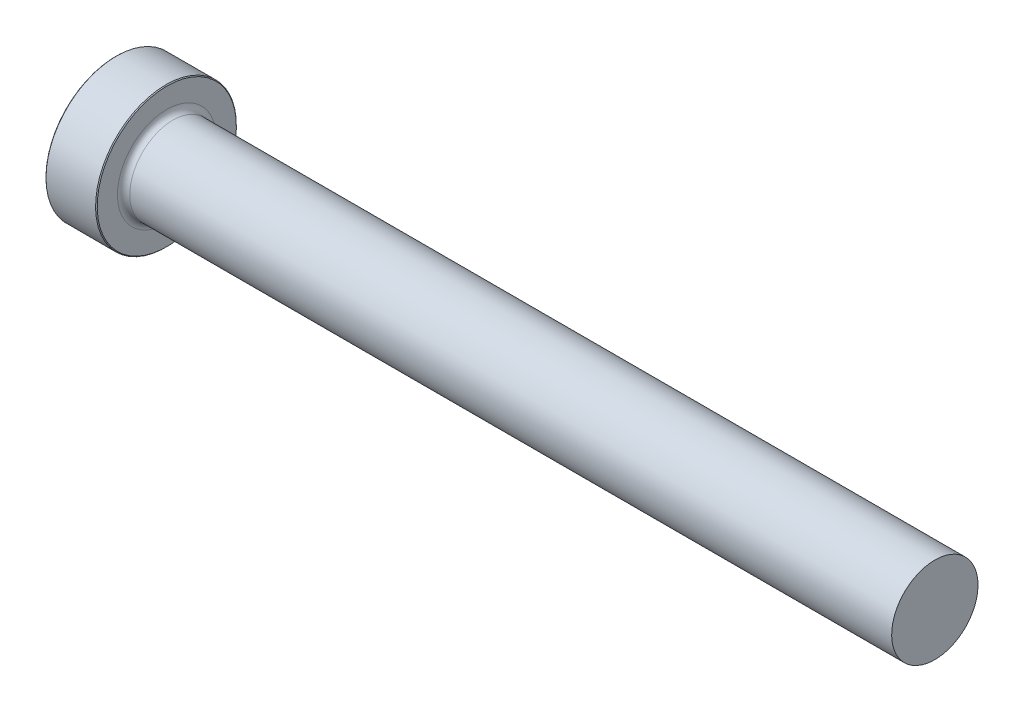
SolidWorks part; units mm, degrees
ref_plane "Front Plane" through (0, 0, 0) normal (0, 0, 1) x (1, 0, 0)
ref_plane "Top Plane" through (0, 0, 0) normal (0, 1, 0) x (1, 0, 0)
ref_plane "Right Plane" through (0, 0, 0) normal (1, 0, 0) x (0, 0, -1)
sketch "Sketch1" plane through (0, 0, 0) normal (0, 0, 1) x (1, 0, 0)
  line L0 (0, 0) -> (0, 8.7312)
  line L1 (0, 8.7312) -> (6.35, 8.7312)
  line L2 (6.35, 8.7312) -> (6.35, 6.116)
  line L3 (7.112, 5.354) -> (101.6, 5.354)
  line L4 (101.6, 5.354) -> (101.6, 0)
  line L5 (101.6, 0) -> (0, 0)
  line L6 (101.6, 0) -> (101.6, -5.354) construction
  line L7 (101.6, -5.354) -> (6.35, -5.354) construction
  line L8 (0, 0) -> (0, -8.7312) construction
  line L9 (0, -8.7312) -> (6.35, -8.7312) construction
  line L10 (6.35, -8.7312) -> (6.35, -5.354) construction
  arc A0 (6.35, 6.116) -> (7.112, 5.354) centre (7.112, 6.116) ccw
  dimension "D4" = 0.762
  dimension "L" = 101.6
  dimension "D" = 10.708
  dimension "H" = 17.4625
  dimension "T" = 6.35
revolve "Revolve1" add sketch "Sketch1" angle 360 about L5
chamfer "Chamfer1" distance 0.1016 angle 45 2 edges at (0, 8.7312, 0) (6.35, 8.7313, 0)
